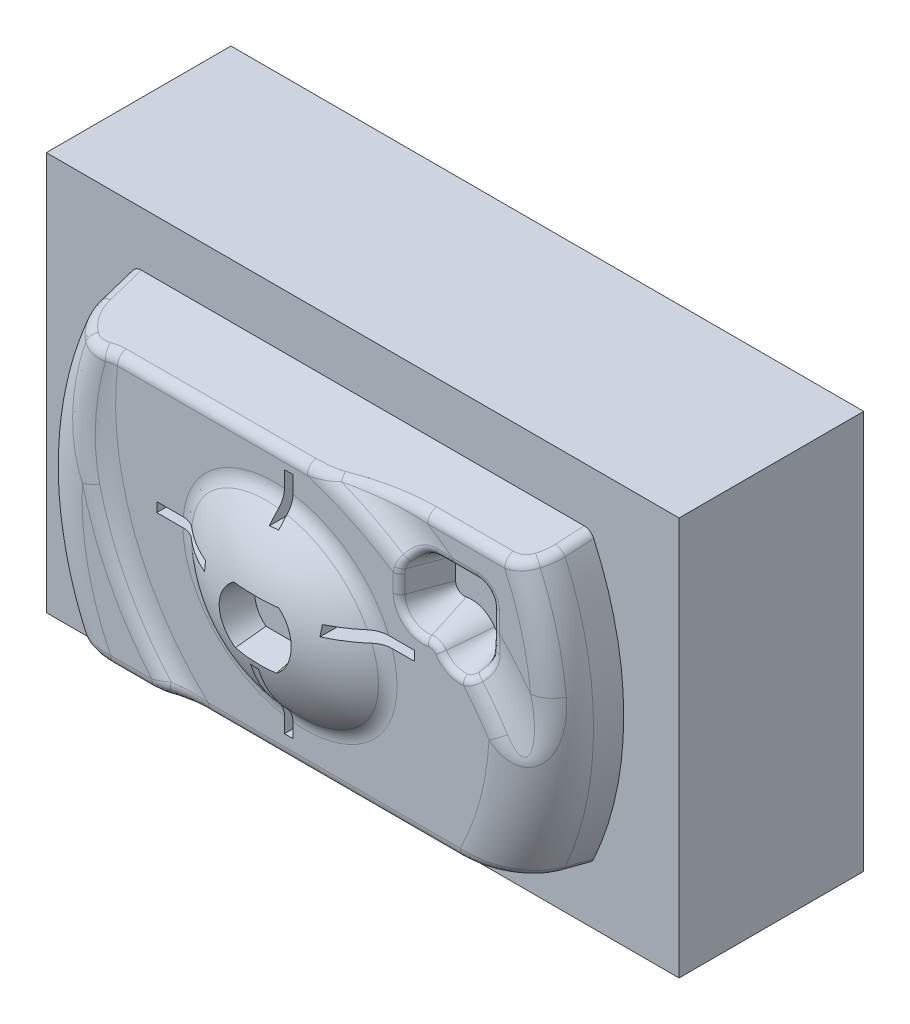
SolidWorks part; units mm, degrees
ref_plane "Front Plane" through (0, 0, 0) normal (0, 0, 1) x (1, 0, 0)
ref_plane "Top Plane" through (0, 0, 0) normal (0, 1, 0) x (1, 0, 0)
ref_plane "Right Plane" through (0, 0, 0) normal (1, 0, 0) x (0, 0, -1)
body saved out of another part "Stock-Camera Body-1"
